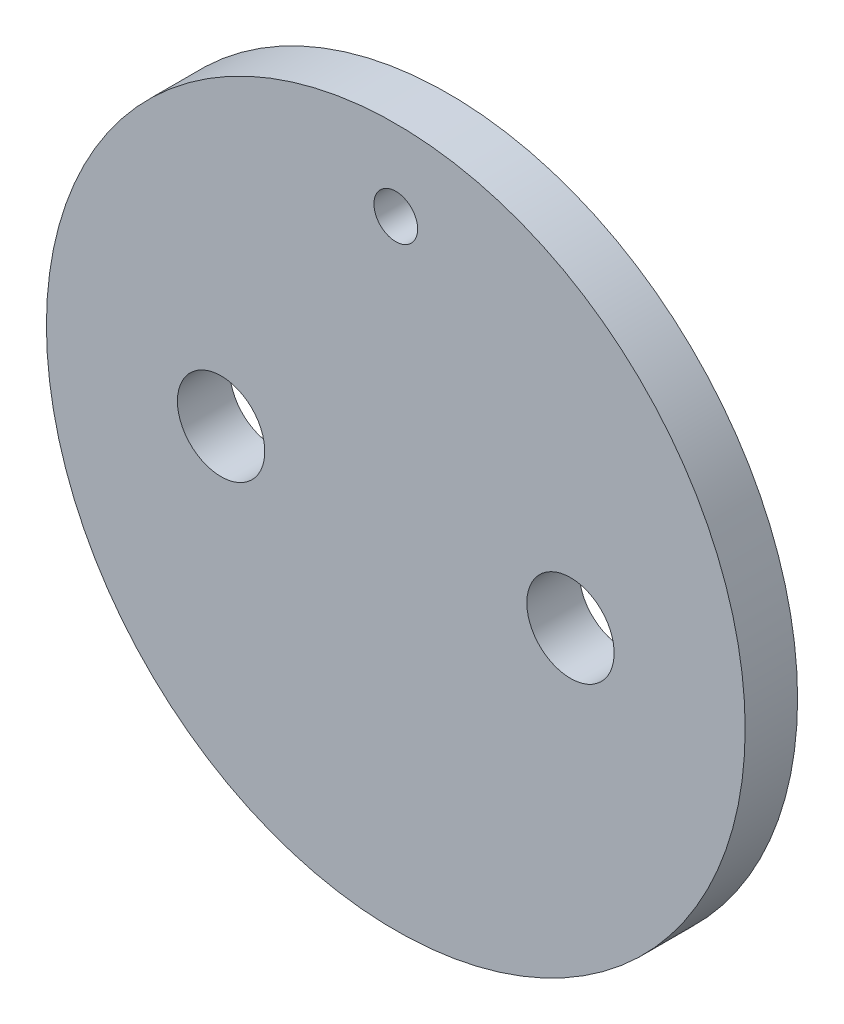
SolidWorks part; units mm, degrees
ref_plane "Front Plane" through (0, 0, 0) normal (0, 0, 1) x (1, 0, 0)
ref_plane "Top Plane" through (0, 0, 0) normal (0, 1, 0) x (1, 0, 0)
ref_plane "Right Plane" through (0, 0, 0) normal (1, 0, 0) x (0, 0, -1)
sketch "Sketch1" plane through (0, 0, 0) normal (0, 0, 1) x (1, 0, 0)
  circle A0 centre (0, 0) radius 25.4
  dimension "D1" = 50.8
extrude "Extrude1" add sketch "Sketch1" along normal blind 3.81
sketch "Sketch2" plane through (0, 0, 0) normal (0, 0, 1) x (1, 0, 0)
  circle A0 centre (0, 19.558) radius 1.5875
  circle A1 centre (12.7, 0) radius 3.175
  circle A2 centre (-12.7, 0) radius 3.175
  dimension "D1" = 3.175
  dimension "D3" = 6.35
  dimension "D4" = 6.35
  dimension "D2" = 19.558
  dimension "D5" = 12.7
  dimension "D6" = 12.7
extrude "Cut-Extrude1" cut sketch "Sketch2" along normal through all
